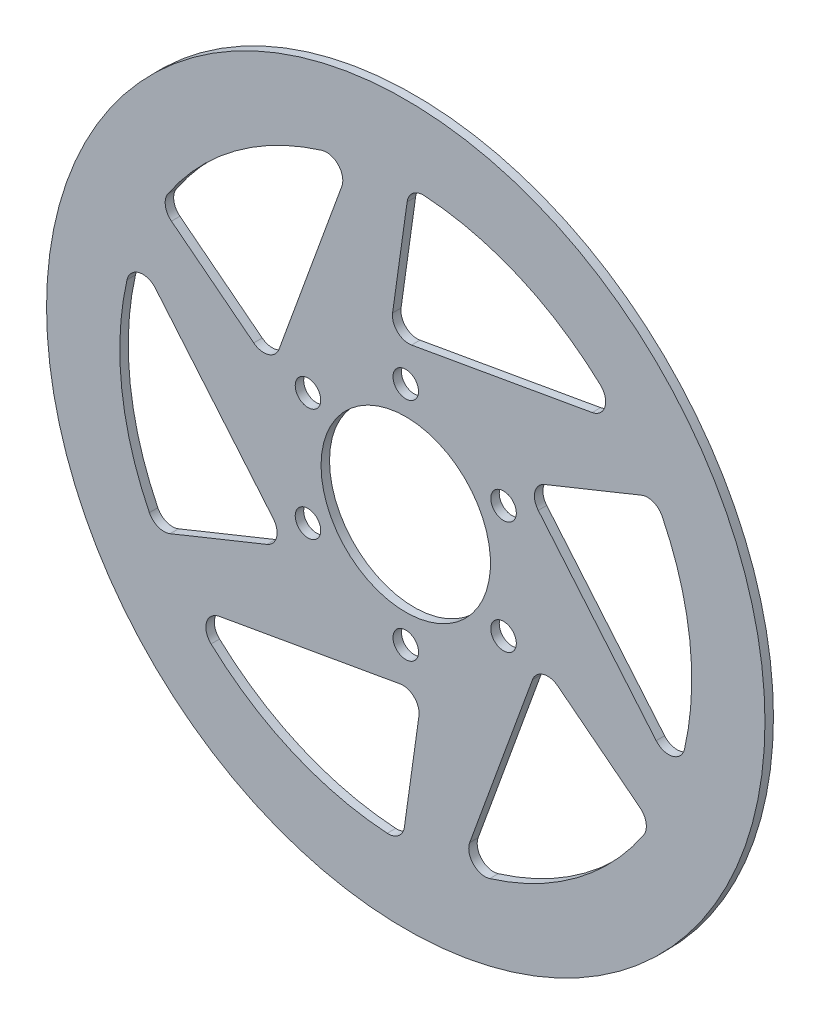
SolidWorks part; units mm, degrees
ref_plane "Front Plane" through (0, 0, 0) normal (0, 0, 1) x (1, 0, 0)
ref_plane "Top Plane" through (0, 0, 0) normal (0, 1, 0) x (1, 0, 0)
ref_plane "Right Plane" through (0, 0, 0) normal (1, 0, 0) x (0, 0, -1)
sketch "Sketch1" plane through (0, 0, 0) normal (0, 0, 1) x (1, 0, 0)
  line L0 (-3.175, 28.3981) -> (0.665, 55.7212)
  line L1 (42.1957, 36.3981) -> (-3.175, 28.3981)
  line L2 (0, 0) -> (0, 84.8514) construction
  circle A0 centre (0, 0) radius 70
  circle A1 centre (0, 22) radius 2.4892
  arc A2 (0.665, 55.7212) -> (42.1957, 36.3981) centre (0, 0) cw
  circle A3 centre (0, 0) radius 16.51
  dimension "D1" = 140
  dimension "D3" = 4.9784
  dimension "D4" = 14.2748
  dimension "D9" = 33.02
  dimension "D2" = 22
  dimension "D5" = 28.575
  dimension "D6" = 3.175
  dimension "D7" = 8
  dimension "D8" = 72
sketch "Sketch2" plane through (0, 0, 0) normal (0, 0, 1) x (1, 0, 0)
  circle A0 centre (0, 0) radius 70 construction
  circle A1 centre (0, 0) radius 70
  circle A2 centre (0, 0) radius 16.51 construction
  circle A3 centre (0, 0) radius 16.51
extrude "Boss-Extrude1" add sketch "Sketch2" along normal blind 1.651
sketch "Sketch3" plane through (0, 0, 0) normal (0, 0, 1) x (1, 0, 0)
  circle A0 centre (0, 22) radius 2.4892 construction
  circle A1 centre (0, 22) radius 2.4892
extrude "Cut-Extrude2" cut sketch "Sketch3" along normal through all
pattern_circular "CirPattern1" count 6 over 360 about axis through (0, 0, 0) along (0, 0, 1) of "Cut-Extrude2"
sketch "Sketch4" plane through (0, 0, 0) normal (0, 0, 1) x (1, 0, 0)
  line L0 (-3.175, 28.3981) -> (0.665, 55.7212) construction
  line L1 (42.1957, 36.3981) -> (-3.175, 28.3981) construction
  line L2 (-2.5668, 32.7255) -> (0.2659, 52.8813)
  line L3 (36.3286, 35.3636) -> (1.1286, 29.1569)
  arc A0 (42.1957, 36.3981) -> (0.665, 55.7212) centre (0, 0) ccw construction
  arc A1 (37.9389, 40.8159) -> (3.616, 55.6078) centre (0, 0) ccw
  arc A2 (37.9389, 40.8159) -> (36.3286, 35.3636) centre (35.7773, 38.4904) cw
  arc A3 (0.2659, 52.8813) -> (3.616, 55.6078) centre (3.41, 52.4394) cw
  arc A4 (-2.5668, 32.7255) -> (1.1286, 29.1569) centre (0.5773, 32.2837) ccw
  dimension "D1" = 3.175
extrude "Cut-Extrude3" cut sketch "Sketch4" along normal through all
pattern_circular "CirPattern2" count 6 over 360 about axis through (0, 0, 0) along (0, 0, 1) of "Cut-Extrude3"
